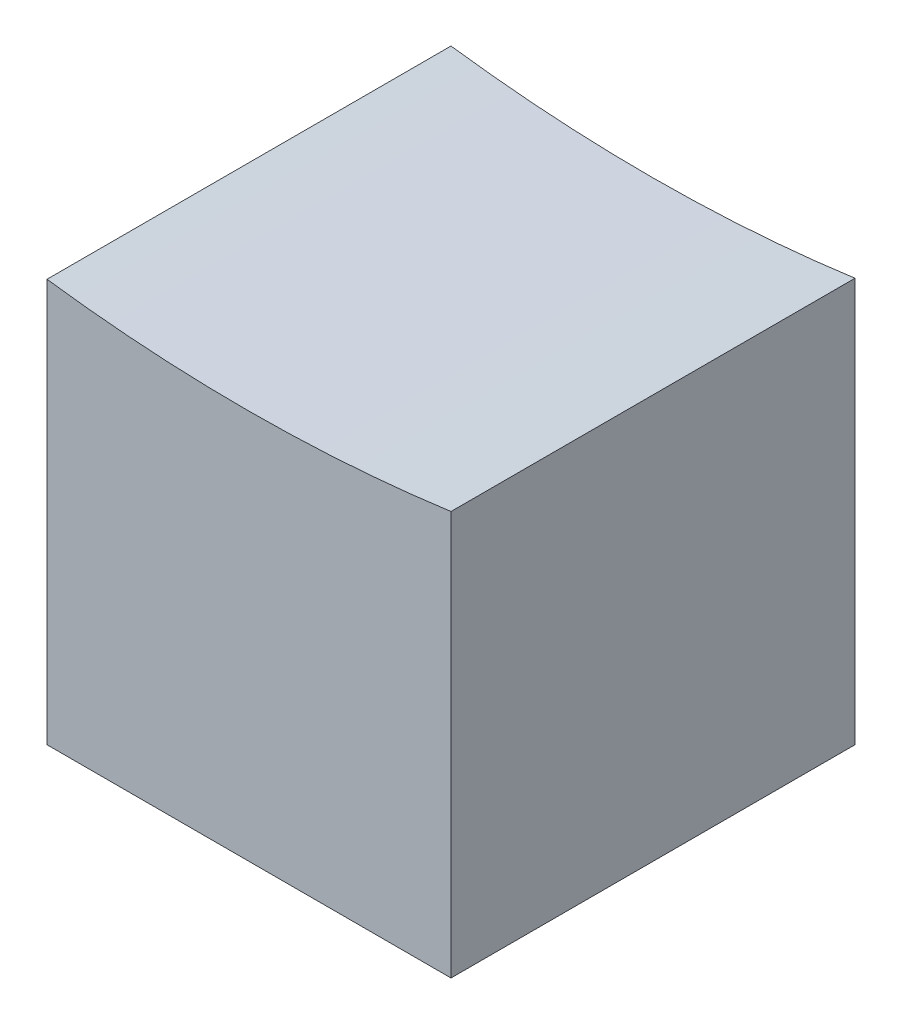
SolidWorks part; units mm, degrees
ref_plane "Front Plane" through (0, 0, 0) normal (0, 0, 1) x (1, 0, 0)
ref_plane "Top Plane" through (0, 0, 0) normal (0, 1, 0) x (1, 0, 0)
ref_plane "Right Plane" through (0, 0, 0) normal (1, 0, 0) x (0, 0, -1)
sketch "Sketch1" plane through (0, 0, 0) normal (0, 0, 1) x (1, 0, 0)
  line L8 (-14.7558, -110.3175) -> (-14.7558, -140.2511)
  line L9 (-14.7558, -140.2511) -> (15.2442, -140.2511)
  line L10 (15.2442, -110.2511) -> (15.2442, -140.2511)
  arc A3 (-14.7558, -110.3175) -> (15.2442, -110.2511) centre (0, 0) ccw
  point P1 (0, 0)
  point P8 (0, 0)
  dimension "D1" = 222.6
  dimension "D2" = 30
  dimension "D3" = 30
extrude "Boss-Extrude1" add sketch "Sketch1" along normal blind 30
